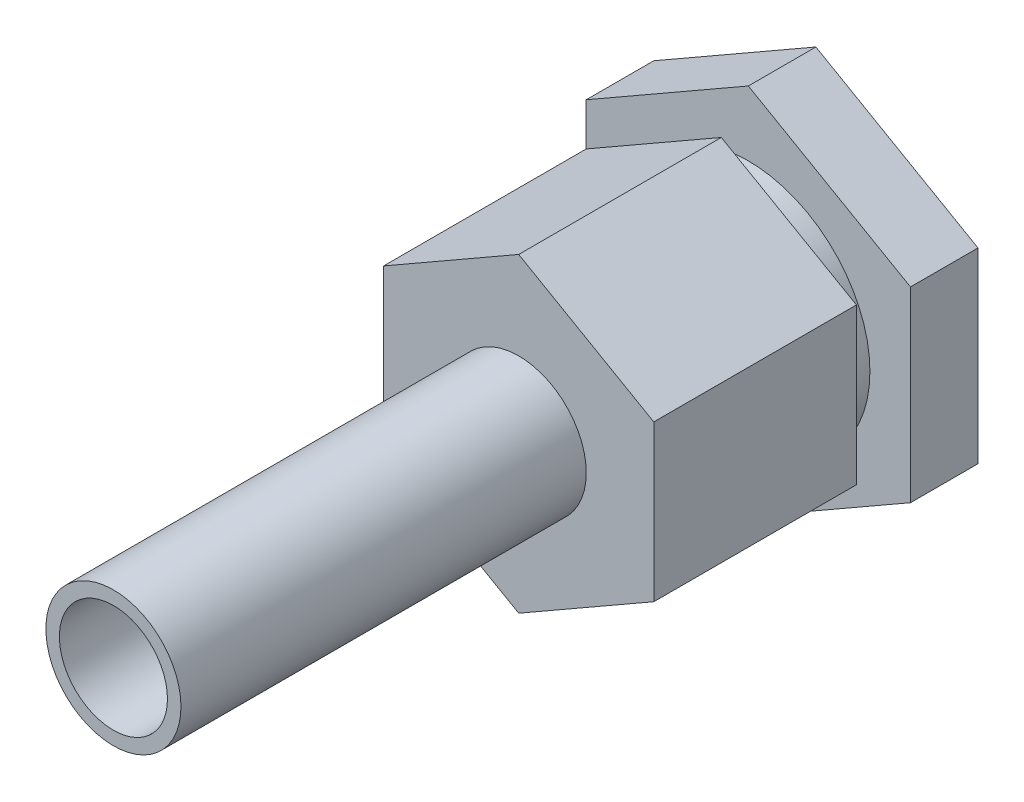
SolidWorks part; units mm, degrees
ref_plane "Plan de face" through (0, 0, 0) normal (0, 0, 1) x (1, 0, 0)
ref_plane "Plan de dessus" through (0, 0, 0) normal (0, 1, 0) x (1, 0, 0)
ref_plane "Plan de droite" through (0, 0, 0) normal (1, 0, 0) x (0, 0, -1)
sketch "Esquisse1" plane through (0, 0, 0) normal (0, 0, 1) x (1, 0, 0)
  line L0 (0, 0) -> (0, 43.8476) construction
  line L1 (0, 0) -> (39.2372, 0) construction
  line L2 (0, 13.8) -> (12, 6.9169)
  line L3 (12, 6.9169) -> (12, -6.9169)
  line L4 (0, -13.8) -> (12, -6.9169)
  line L5 (0, -13.8) -> (-12, -6.9169)
  line L6 (-12, 6.9169) -> (-12, -6.9169)
  line L7 (0, 13.8) -> (-12, 6.9169)
  circle A0 centre (0, 0) radius 8
  point P8 (12, 0)
  point P11 (-12, 0)
  dimension "D3" = 16
  dimension "D1" = 24
  dimension "D2" = 27.6
extrude "Extrusion1" add sketch "Esquisse1" along normal blind 5
sketch "Esquisse2" plane through (0, 0, 0) normal (0, 0, 1) x (1, 0, 0)
  circle A0 centre (0, 0) radius 9
  dimension "D1" = 18
extrude "Extrusion2" add sketch "Esquisse2" along normal blind 9 from offset 2
sketch "Esquisse3" plane through (0, 0, 7) normal (0, 0, 1) x (1, 0, 0)
  line L0 (0, 0) -> (0, 20.2617) construction
  line L1 (0, 0) -> (16.3785, 0) construction
  line L2 (0, 11.5) -> (10, 5.7641)
  line L3 (10, 5.7641) -> (10, -5.7641)
  line L4 (0, -11.5) -> (10, -5.7641)
  line L5 (0, -11.5) -> (-10, -5.7641)
  line L6 (-10, 5.7641) -> (-10, -5.7641)
  line L7 (0, 11.5) -> (-10, 5.7641)
  point P8 (10, 0)
  point P11 (-10, 0)
  dimension "D1" = 20
  dimension "D2" = 23
extrude "Extrusion3" add sketch "Esquisse3" along normal blind 15
sketch "Esquisse4" plane through (0, 0, 22) normal (0, 0, 1) x (1, 0, 0)
  circle A0 centre (0, 0) radius 5
  dimension "D1" = 10
extrude "Extru.-Mince1" add sketch "Esquisse4" along normal blind 30 thin
